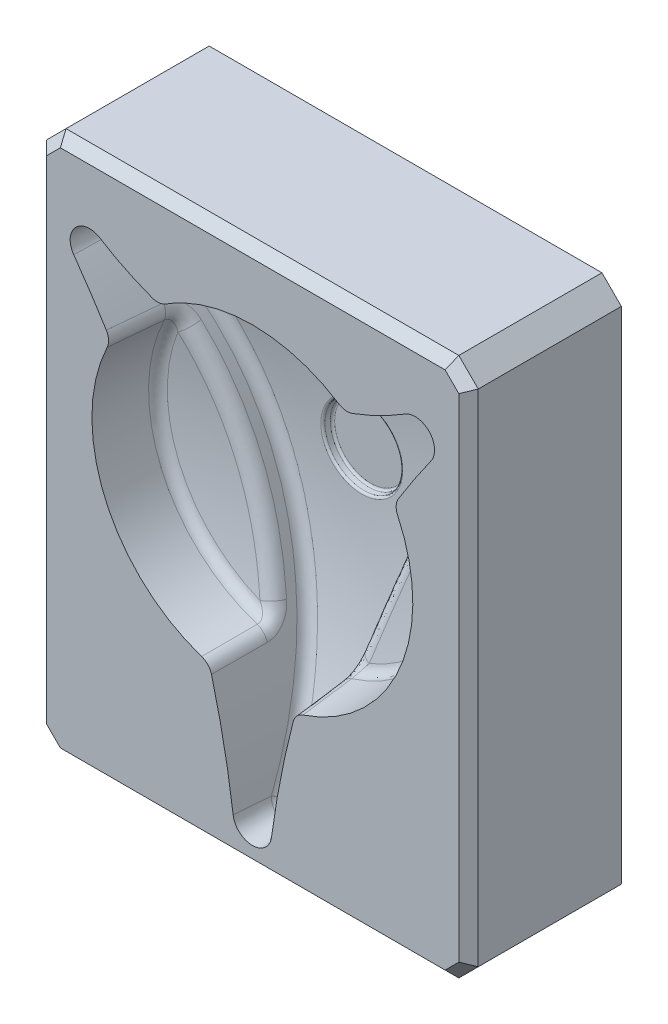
SolidWorks part; units mm, degrees
ref_plane "Front Plane" through (0, 0, 0) normal (0, 0, 1) x (1, 0, 0)
ref_plane "Top Plane" through (0, 0, 0) normal (0, 1, 0) x (1, 0, 0)
ref_plane "Right Plane" through (0, 0, 0) normal (1, 0, 0) x (0, 0, -1)
sketch3d "3DSketch1"
  point P0 (-35.2402, -51.0016, 0)
  point P1 (35.3629, 37.2012, -25)
imported_body "Surface-Imported1"
surface "Surface-Plane1"
surface "Surface-Knit1"
chamfer "Chamfer1" distance 3.175 angle 45 4 edges
chamfer "Chamfer2" distance 1.5875 angle 45 9 edges at (-33.6527, -49.4141, 0) (-33.6527, 35.6137, 0) (0.0614, 37.2012, 0) (33.7754, 35.6137, 0) (33.7754, -49.4141, 0)
